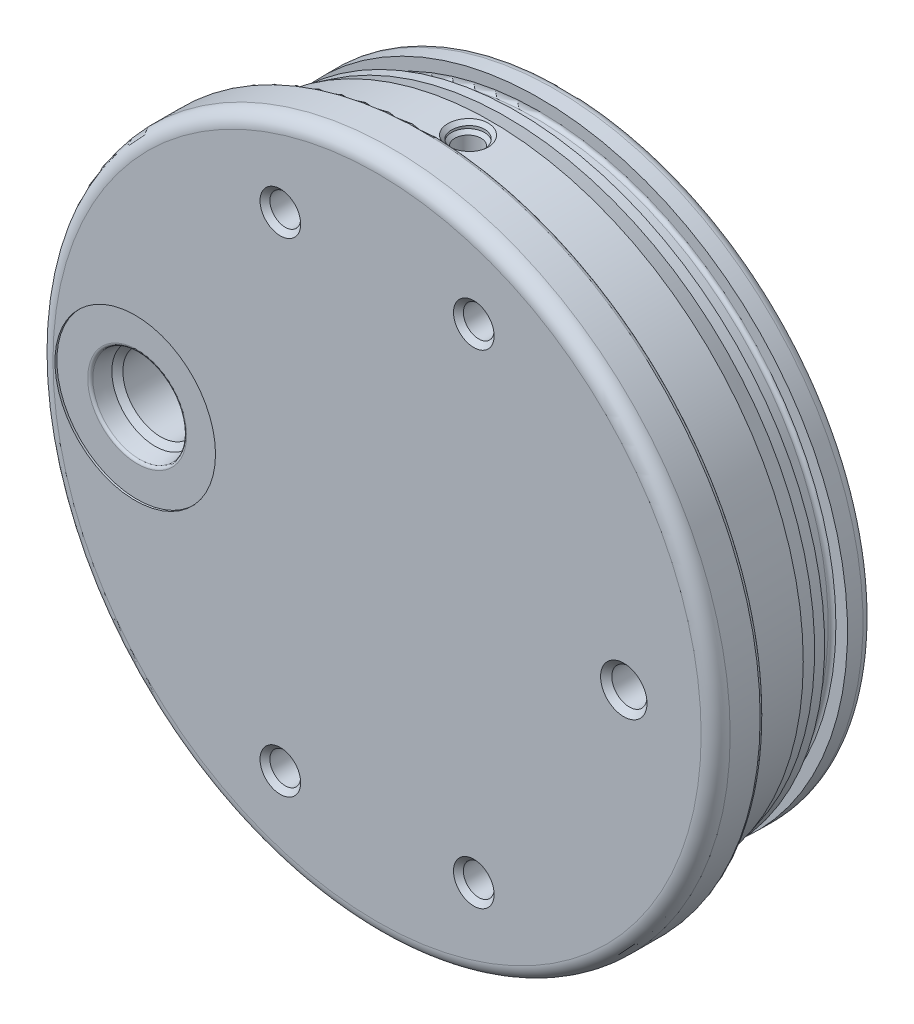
SolidWorks part; units mm, degrees
ref_plane "Front Plane" through (0, 0, 0) normal (0, 0, 1) x (1, 0, 0)
ref_plane "Top Plane" through (0, 0, 0) normal (0, 1, 0) x (1, 0, 0)
ref_plane "Right Plane" through (0, 0, 0) normal (1, 0, 0) x (0, 0, -1)
sketch "Sketch1" plane through (0, 0, 0) normal (1, 0, 0) x (0, 0, -1)
  line L0 (0, 0) -> (-31.3505, 0) construction
  line L1 (0, 0) -> (0, 39.1541)
  line L2 (-1.27, 40.4241) -> (-3.302, 40.4241)
  line L3 (-3.302, 40.4241) -> (-3.302, 38.9001)
  line L4 (-3.81, 38.3921) -> (-5.8011, 38.3921)
  line L5 (-6.3091, 38.9001) -> (-6.3091, 40.4241)
  line L6 (-6.3091, 40.4241) -> (-7.62, 40.4241)
  line L11 (-7.62, 40.4241) -> (-9.6581, 40.9702)
  line L12 (-9.6581, 40.9702) -> (-17.526, 40.9702)
  line L13 (-18.288, 41.7322) -> (-18.288, 44.45)
  line L14 (-18.288, 44.45) -> (-24.638, 44.45)
  line L15 (-24.638, 44.45) -> (-24.638, 0)
  line L16 (0, 0) -> (-24.638, 0)
  line L17 (-17.399, 41.1353) -> (-9.7523, 41.1353) construction
  arc A0 (-17.526, 40.9702) -> (-18.288, 41.7322) centre (-17.526, 41.7322) cw
  arc A1 (-3.302, 38.9001) -> (-3.81, 38.3921) centre (-3.81, 38.9001) cw
  arc A2 (-5.8011, 38.3921) -> (-6.3091, 38.9001) centre (-5.8011, 38.9001) cw
  arc A5 (0, 39.1541) -> (-1.27, 40.4241) centre (-1.27, 39.1541) ccw
  point P32 (-18.288, 40.9702)
  point P35 (-3.302, 38.3921)
  point P38 (-6.3091, 38.3921)
  dimension "D13" = 0.762
  dimension "D14" = 0.508
  dimension "D15" = 1.27
  dimension "D1" = 80.8482
  dimension "D2" = 76.7842
  dimension "D3" = 3.0071
  dimension "D4" = 3.302
  dimension "D5" = 1.3109
  dimension "D6" = 18.288
  dimension "D7" = 15
  dimension "D8" = 10.668
  dimension "D9" = 81.9404
  dimension "D10" = 8.6299
  dimension "D11" = 6.35
  dimension "D12" = 88.9
  dimension "D16" = 2.032
  dimension "D17" = 0.1651
revolve "Revolve1" add sketch "Sketch1" angle 360 about L0
fillet "Fillet1" radius 0.508 1 edges at (-44.45, 0, 18.288)
ref_plane "Plane1" through (0, 40.9702, 0) normal (0, 1, 0) x (1, 0, 0)
hole_wizard "#8-32 Tapped Hole1" positions "Sketch2" profile "Sketch3" tap size "#8-32" standard "ANSI Inch"
sketch "Sketch2" plane through (0, 40.9702, 0) normal (0, 1, 0) x (1, 0, 0)
  point P0 (0, -12.7)
sketch "Sketch3" plane through (0, 40.9702, 12.7) normal (1, 0, 0) x (0, 0, 1)
  line L0 (0, 0) -> (0, 11.1978)
  line L1 (0, 11.1978) -> (1.7272, 10.16)
  line L2 (1.7272, 10.16) -> (1.7272, 0.4318)
  line L3 (1.7272, 0.4318) -> (2.159, 0)
  line L5 (2.159, 0) -> (0, 0)
  line L6 (-1.7272, 0.4318) -> (-2.159, 0) construction
  line L10 (0, 11.1978) -> (-1.7272, 10.16) construction
  line L11 (0, -6.35) -> (0, 107.95) construction
  dimension "Tap Drill Dia." = 3.4544
  dimension "Tap Drill Depth" = 10.16
  dimension "Near C'Sink Dia." = 4.318
  dimension "Near C'Sink Angle" = 90
  dimension "Drill Angle" = 118
sketch "Sketch4" plane through (0, 40.9702, 0) normal (0, 1, 0) x (1, 0, 0)
  circle A0 centre (0, -12.7) radius 2.159
  dimension "D1" = 4.318
extrude "Cut-Extrude1" cut sketch "Sketch4" against normal blind 0.762
chamfer "Chamfer2" distance 0.508 angle 45 1 edges at (0, 40.2082, 14.4272)
chamfer "Chamfer1" distance 0.508 angle 45 1 edges at (-0.4932, 40.9672, 10.5981)
pattern_circular "CirPattern1" count 2 over 360 about axis through (0, 0, 0) along (0, 0, -1) of "Cut-Extrude1", "#8-32 Tapped Hole1", "Chamfer2", "Chamfer1"
sketch "Sketch6" plane through (0, 40.9702, 0) normal (0, 1, 0) x (1, 0, 0)
  circle A0 centre (0, -12.7) radius 3.429
  dimension "D1" = 6.858
sketch "Sketch7" plane through (0, 0, 0) normal (1, 0, 0) x (0, 0, -1)
  line L0 (0, 0) -> (-37.4487, 0) construction
  line L1 (-17.526, 0) -> (-17.526, 11.2495)
  line L2 (-13.8063, 20.2297) -> (0, 34.036)
  line L3 (0, -39.1541) -> (0, 39.1541) construction
  line L4 (0, 34.036) -> (0, 0)
  line L7 (0, 0) -> (-17.526, 0)
  line L8 (-24.638, 44.45) -> (-24.638, -44.45) construction
  arc A0 (-17.526, 11.2495) -> (-13.8063, 20.2297) centre (-4.826, 11.2495) cw
  dimension "D4" = 12.7
  dimension "D1" = 68.072
  dimension "D2" = 7.112
  dimension "D3" = 45
  dimension "D5" = 40.4595
revolve "Cut-Revolve1" cut sketch "Sketch7" angle 360 about L0
sketch "Sketch8" plane through (0, 0, 24.638) normal (0, 0, 1) x (1, 0, 0)
  line L0 (0, 23.9836) -> (0, 0) construction
  line L1 (0, 0) -> (30.48, 0) construction
  circle A0 centre (30.48, 0) radius 11.43
  circle A1 centre (-30.48, 0) radius 11.43
  circle A2 centre (0, 0) radius 30.48 construction
  dimension "D1" = 22.86
  dimension "D2" = 60.96
  dimension "D3" = 0
  dimension "D4" = 90
extrude "Cut-Extrude3" [suppressed] cut sketch "Sketch8" against normal blind 0.254
hole_wizard "7/16-20 Tapped Hole1" positions "Sketch9" profile "Sketch10" tap size "7/16-20" standard "ANSI Inch"
sketch "Sketch9" [suppressed] plane through (0, 0, 24.384) normal (0, 0, 1) x (1, 0, 0)
  point P0 (-30.48, 0)
  point P3 (30.48, 0)
sketch "Sketch10" plane through (-30.48, 0, 24.384) normal (1, 0, 0) x (0, -1, 0)
  line L0 (0, 0) -> (0, 25.8406)
  line L1 (0, 25.8406) -> (4.9606, 22.86)
  line L2 (4.9606, 22.86) -> (4.9606, 0)
  line L5 (4.9606, 0) -> (0, 0)
  line L10 (0, 25.8406) -> (-4.9606, 22.86) construction
  line L11 (0, -6.35) -> (0, 107.95) construction
  dimension "Tap Drill Dia." = 9.9212
  dimension "Tap Drill Depth" = 22.86
  dimension "Drill Angle" = 118
fillet "Fillet2" radius 1.905 1 edges at (-44.45, 0, 24.638)
sketch "Sketch11" plane through (0, 0, 0) normal (0, 0, -1) x (-1, 0, 0)
  circle A0 centre (0, 0) radius 35.56
  dimension "D1" = 71.12
extrude "Cut-Extrude4" cut sketch "Sketch11" against normal blind 9.144 draft 15
sketch "Sketch12" plane through (0, 0, 9.144) normal (0, 0, -1) x (-1, 0, 0)
  line L0 (-25.5413, 25.5413) -> (-27.1473, 27.1473) construction
  line L1 (0, 0) -> (-21.59, 21.59) construction
  line L2 (0, 0) -> (0, 29.3965) construction
  circle A0 centre (0, 0) radius 23.876
  circle A1 centre (-21.59, 21.59) radius 5.588 construction
  circle A3 centre (0, 0) radius 38.3921 construction
  circle A4 centre (0, 0) radius 38.3921 construction
  dimension "D1" = 47.752
  dimension "D2" = 11.176
  dimension "D3" = 2.2712
  dimension "D4" = 43.18
  dimension "D5" = 45
extrude "Cut-Extrude5" cut sketch "Sketch12" against normal up to surface (8.382 mm away)
fillet "Fillet3" radius 8.128 1 edges at (-33.1099, 0, 9.144)
chamfer "Chamfer3" distance 0.762 angle 45 1 edges at (-35.56, 0, 0)
fillet "Fillet4" radius 3.81 1 edges at (23.876, 0, 17.526)
fillet "Fillet5" [suppressed] radius 0.762
sketch "Sketch13" plane through (0, 0, 24.638) normal (0, 0, 1) x (1, 0, 0)
  line L0 (0, 0) -> (58.3444, 0) construction
  line L1 (0, 0) -> (19.7935, 19.7935) construction
  circle A0 centre (0, 0) radius 11.43
  dimension "D1" = 22.86
  dimension "D2" = 45
extrude "Cut-Extrude6" [suppressed] cut sketch "Sketch13" against normal blind 0.254
sketch "Sketch14" [suppressed] plane through (0, 0, 28.448) normal (0, 0, 1) x (1, 0, 0)
  circle A0 centre (0, 0) radius 5.715
  dimension "D1" = 11.43
extrude "Cut-Extrude7" [suppressed] cut sketch "Sketch14" against normal through all
chamfer "Chamfer4" [suppressed] distance 0.254 angle 45
sketch "Sketch15" plane through (0, 0, 9.144) normal (0, 0, -1) x (-1, 0, 0)
  line L0 (0, 0) -> (0, 53.8221) construction
  line L1 (0, 0) -> (-24.13, 16.4611) construction
  line L2 (-19.6911, 15.322) -> (-20.9241, 19.7357) construction
  line L3 (-20.9241, 19.7357) -> (-25.363, 20.8748) construction
  line L4 (-25.363, 20.8748) -> (-28.5689, 17.6001) construction
  line L5 (-28.5689, 17.6001) -> (-27.3359, 13.1864) construction
  line L6 (-27.3359, 13.1864) -> (-22.897, 12.0473) construction
  line L7 (-22.897, 12.0473) -> (-19.6911, 15.322) construction
  circle A0 centre (-24.13, 16.4611) radius 4.7625
  circle A1 centre (-24.13, 16.4611) radius 3.9688 construction
  circle A2 centre (0, 0) radius 29.21 construction
  circle A3 centre (-24.13, 16.4611) radius 2.159 construction
  circle A4 centre (24.13, 16.4611) radius 4.7625
  dimension "D1" = 9.525
  dimension "D2" = 7.9375
  dimension "D4" = 58.42
  dimension "D6" = 4.318
  dimension "D3" = 48.26
  dimension "D5" = 55.699
extrude "Cut-Extrude8" [suppressed] cut sketch "Sketch15" along normal through all
hole_wizard "#8-32 Tapped Hole2" positions "Sketch16" profile "Sketch17" tap size "#8-32" standard "ANSI Inch"
sketch "Sketch16" [suppressed] plane through (0, 0, 9.144) normal (0, 0, -1) x (-1, 0, 0)
  arc A0 (24.1928, 11.699) -> (19.7191, 18.257) centre (24.13, 16.4611) ccw construction
  arc A1 (-19.7191, 18.257) -> (-24.1928, 11.699) centre (-24.13, 16.4611) ccw construction
  point P9 (24.13, 16.4611)
  point P11 (-24.13, 16.4611)
sketch "Sketch17" plane through (-24.13, 16.4611, 9.144) normal (1, 0, 0) x (0, 1, 0)
  line L0 (0, 0) -> (0, 12.192)
  line L1 (0, 12.192) -> (1.7272, 11.1542)
  line L2 (1.7272, 11.1542) -> (1.7272, 0.5588)
  line L3 (1.7272, 0.5588) -> (2.286, 0)
  line L5 (2.286, 0) -> (0, 0)
  line L6 (-1.7272, 0.5588) -> (-2.286, 0) construction
  line L10 (0, 12.192) -> (-1.7272, 11.1542) construction
  line L11 (0, -6.35) -> (0, 107.95) construction
  dimension "Tap Drill Dia." = 3.4544
  dimension "Tap Drill Depth" = 12.192
  dimension "Near C'Sink Dia." = 4.572
  dimension "Near C'Sink Angle" = 90
  dimension "Drill Angle" = 118
hole_wizard "#10-32 Tapped Hole1" positions "Sketch18" profile "Sketch19" tap size "#10-32" standard "ANSI Inch"
sketch "Sketch18" plane through (0, 0, 24.638) normal (0, 0, 1) x (1, 0, 0)
  line L0 (0, 0) -> (0, -92.6816) construction
  line L2 (0, 0) -> (-77.9465, 0) construction
  point P0 (12.7, -31.75)
  point P2 (-12.7, -31.75)
  point P16 (-12.7, 31.75)
  point P17 (12.7, 31.75)
  dimension "D1" = 31.75
  dimension "D2" = 25.4
sketch "Sketch19" plane through (12.7, -31.75, 24.638) normal (1, 0, 0) x (0, -1, 0)
  line L0 (0, 0) -> (0, 11.938)
  line L1 (0, 11.938) -> (2.0193, 10.7247)
  line L2 (2.0193, 10.7247) -> (2.0193, 0.6477)
  line L3 (2.0193, 0.6477) -> (2.667, 0)
  line L5 (2.667, 0) -> (0, 0)
  line L6 (-2.0193, 0.6477) -> (-2.667, 0) construction
  line L10 (0, 11.938) -> (-2.0193, 10.7247) construction
  line L11 (0, -6.35) -> (0, 107.95) construction
  dimension "Tap Drill Dia." = 4.0386
  dimension "Tap Drill Depth" = 11.938
  dimension "Near C'Sink Dia." = 5.334
  dimension "Near C'Sink Angle" = 90
  dimension "Drill Angle" = 118
hole_wizard "#12-28 Tapped Hole1" positions "Sketch20" profile "Sketch21" tap size "#12-28" standard "ANSI Inch"
sketch "Sketch20" plane through (0, 0, 24.638) normal (0, 0, 1) x (1, 0, 0)
  line L0 (0, -53.3847) -> (0, 0) construction
  line L1 (0, 0) -> (32.385, 0) construction
  circle A0 centre (0, 0) radius 32.385
  circle A1 centre (32.385, 0) radius 10.4775
  point P0 (32.385, 0)
  dimension "D1" = 64.77
  dimension "D3" = 20.955
  dimension "D2" = 90
sketch "Sketch21" plane through (32.385, 0, 24.638) normal (1, 0, 0) x (0, -1, 0)
  line L0 (0, 0) -> (0, 13.716)
  line L1 (0, 13.716) -> (2.3114, 12.3272)
  line L2 (2.3114, 12.3272) -> (2.3114, 0.7366)
  line L3 (2.3114, 0.7366) -> (3.048, 0)
  line L5 (3.048, 0) -> (0, 0)
  line L6 (-2.3114, 0.7366) -> (-3.048, 0) construction
  line L10 (0, 13.716) -> (-2.3114, 12.3272) construction
  line L11 (0, -6.35) -> (0, 107.95) construction
  dimension "Tap Drill Dia." = 4.6228
  dimension "Tap Drill Depth" = 13.716
  dimension "Near C'Sink Dia." = 6.096
  dimension "Near C'Sink Angle" = 90
  dimension "Drill Angle" = 118
sketch "Sketch22" plane through (0, 0, 24.638) normal (0, 0, 1) x (1, 0, 0)
  line L0 (0, -52.6535) -> (0, 0) construction
  line L1 (0, 0) -> (-55.5951, 0) construction
  line L2 (0, 0) -> (30.48, 0) construction
  line L3 (0, 0) -> (30.48, 0) construction
  circle A0 centre (-31.75, 0) radius 10.541
  circle A1 centre (0, 0) radius 31.75 construction
  dimension "D3" = 21.082
  dimension "D4" = 63.5
  dimension "D1" = 90
  dimension "D2" = 90
extrude "Cut-Extrude9" cut sketch "Sketch22" against normal blind 0.254
hole_wizard "7/16-20 Tapped Hole2" positions "Sketch23" profile "Sketch24" tap size "7/16-20" standard "ANSI Inch"
sketch "Sketch23" plane through (0, 0, 24.384) normal (0, 0, 1) x (1, 0, 0)
  point P0 (-31.75, 0)
sketch "Sketch24" plane through (-31.75, 0, 24.384) normal (1, 0, 0) x (0, -1, 0)
  line L0 (0, 0) -> (0, 13.97)
  line L1 (0, 13.97) -> (4.9606, 10.9894)
  line L2 (4.9606, 10.9894) -> (4.9606, 0)
  line L5 (4.9606, 0) -> (0, 0)
  line L10 (0, 13.97) -> (-4.9606, 10.9894) construction
  line L11 (0, -6.35) -> (0, 107.95) construction
  dimension "Tap Drill Dia." = 9.9212
  dimension "Tap Drill Depth" = 13.97
  dimension "Drill Angle" = 118
sketch "Sketch25" plane through (0, 0, 24.384) normal (0, 0, 1) x (1, 0, 0)
  circle A0 centre (-31.75, 0) radius 0.8001
  dimension "D1" = 1.6002
extrude "Cut-Extrude10" cut sketch "Sketch25" against normal through all
ref_plane "Plane2" through (0, 0, 0) normal (0, 1, 0) x (0, 0, 1)
sketch "Sketch26" plane through (0, 0, 0) normal (0, 1, 0) x (0, 0, 1)
  line L0 (12.446, -31.75) -> (20.232, -31.75) construction
  line L1 (7.9954, -31.75) -> (10.8947, -31.75) construction
  line L3 (13.3946, -31.75) -> (24.384, -31.75) construction
  line L4 (24.384, -25.5651) -> (22.0218, -26.0672)
  line L5 (24.384, -42.291) -> (24.384, -21.209) construction
  line L6 (22.0218, -26.0672) -> (16.339, -31.75)
  line L7 (16.339, -31.75) -> (24.384, -31.75)
  line L8 (24.384, -31.75) -> (24.384, -25.5651)
  dimension "D1" = 45
  dimension "D2" = 12
  dimension "D3" = 2.3622
  dimension "D4" = 12.3698
revolve "Cut-Revolve2" cut sketch "Sketch26" angle 360 about L0
fillet "Fillet6" radius 0.381 1 edges at (-37.9349, 0, 24.384)
